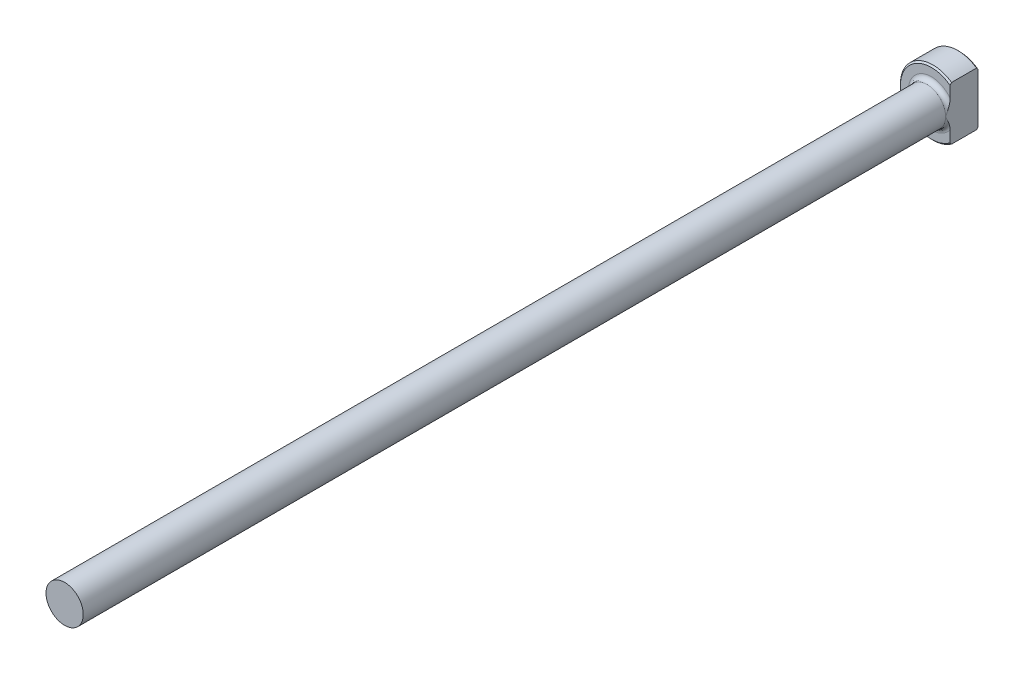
SolidWorks part; units mm, degrees
ref_plane "Front Plane" through (0, 0, 0) normal (0, 0, 1) x (1, 0, 0)
ref_plane "Top Plane" through (0, 0, 0) normal (0, 1, 0) x (1, 0, 0)
ref_plane "Right Plane" through (0, 0, 0) normal (1, 0, 0) x (0, 0, -1)
sketch "Sketch2" plane through (0, 0, 0) normal (1, 0, 0) x (0, 0, 1)
  line L0 (-2.1475, 0) -> (296.5115, 0) construction
  line L1 (152.4, 0) -> (0, 0)
  line L2 (0, 0) -> (0, 5.5499)
  line L3 (0, 5.5499) -> (4.7498, 5.5499)
  line L4 (4.7498, 3.937) -> (4.7498, 5.5499)
  line L7 (5.5118, 3.175) -> (152.4, 3.175)
  line L8 (152.4, 0) -> (152.4, 3.175)
  arc A0 (5.5118, 3.175) -> (4.7498, 3.937) centre (5.5118, 3.937) cw
revolve "Revolve1" add sketch "Sketch2" angle 360 about L0
sketch "Sketch4" plane through (0, 0, 0) normal (0, 0, 1) x (1, 0, 0)
  line L1 (3.175, 4.552) -> (3.175, -4.552)
  arc A3 (3.175, -4.552) -> (3.175, 4.552) centre (0, 0) ccw
extrude "Cut-Extrude2" cut sketch "Sketch4" along normal blind 7.62
chamfer "Chamfer1" distance 0.254 angle 45 2 edges at (-5.5499, 0, 4.7498) (-5.5499, 0, 0)
equation "\"D1@Sketch4\"=0.5*\"D3@Sketch2\""
equation "\"D2@Sketch4\"=\"D1@Sketch2\""
